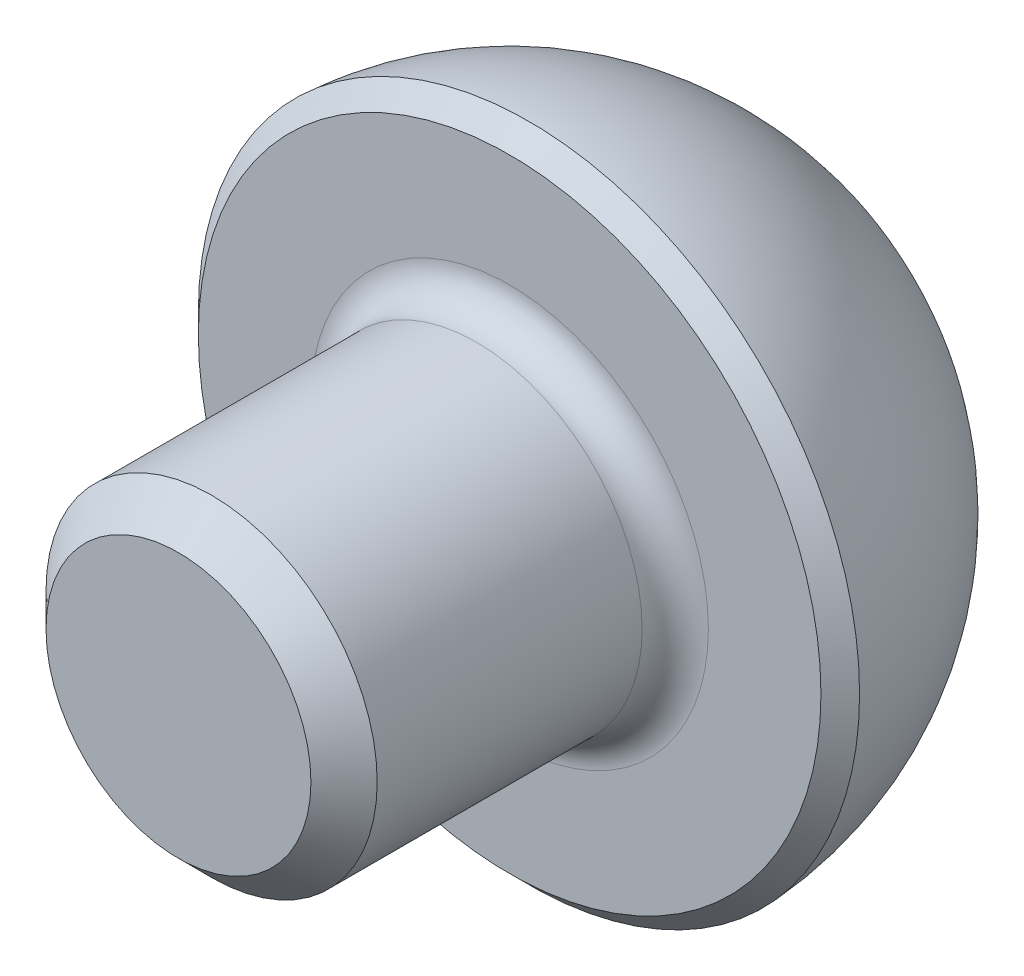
SolidWorks part; units mm, degrees
ref_plane "Front" through (0, 0, 0) normal (0, 0, 1) x (1, 0, 0)
ref_plane "Top" through (0, 0, 0) normal (0, 1, 0) x (1, 0, 0)
ref_plane "Right" through (0, 0, 0) normal (1, 0, 0) x (0, 0, -1)
sketch "Sketch1" plane through (0, 0, 0) normal (0, 1, 0) x (1, 0, 0)
  line L0 (0, 0) -> (2.5, 0)
  line L1 (2.5, 0) -> (2.5, 5)
  line L2 (2.5, 5) -> (5, 5)
  line L3 (0, 10) -> (0, 0)
  line L4 (0, 10) -> (-3.5983, 10) construction
  line L5 (0, 0) -> (0, -3.8888) construction
  arc A0 (5, 5) -> (0, 10) centre (0, 5) ccw
  dimension "D1" = 5
  dimension "D2" = 10
  dimension "D3" = 10
revolve "Revolve1" add sketch "Sketch1" angle 360 about L5
chamfer "Chamfer1" distance 0.5 angle 45 1 edges at (-2.5, 0, 0)
fillet "Fillet1" radius 0.5 1 edges at (-2.5, 0, -5)
chamfer "Chamfer2" distance 0.3 angle 45 1 edges at (-5, 0, -5)
